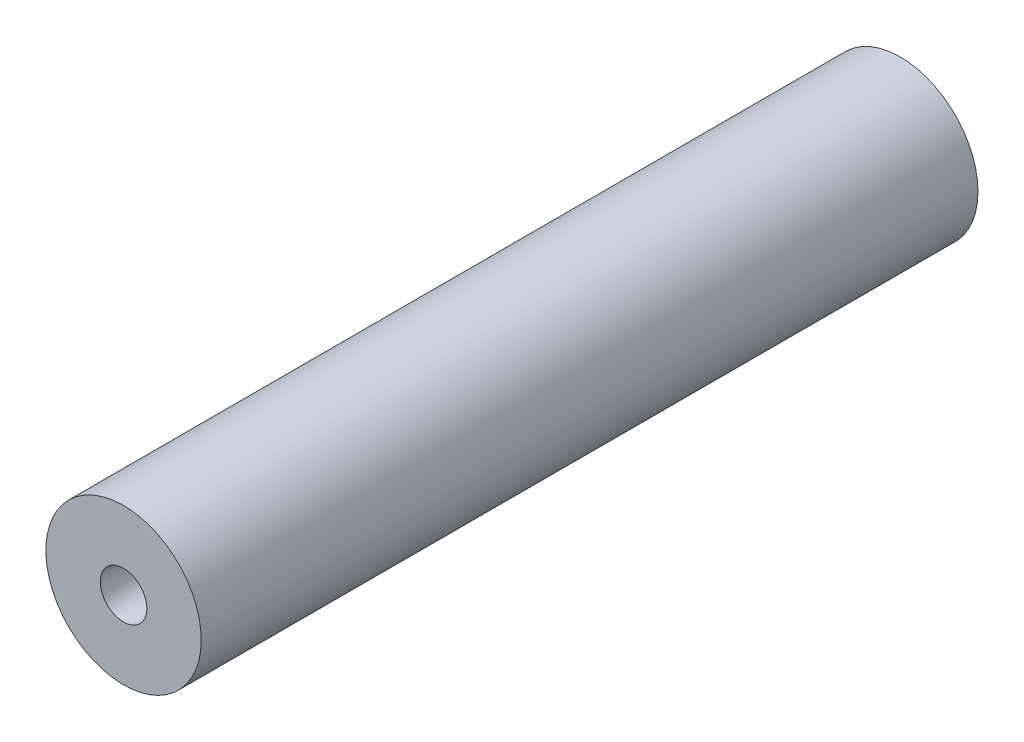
SolidWorks part; units mm, degrees
ref_plane "Plan de face" through (0, 0, 0) normal (0, 0, 1) x (1, 0, 0)
ref_plane "Plan de dessus" through (0, 0, 0) normal (0, 1, 0) x (1, 0, 0)
ref_plane "Plan de droite" through (0, 0, 0) normal (1, 0, 0) x (0, 0, -1)
sketch "Esquisse1" plane through (0, 0, 0) normal (0, 0, 1) x (1, 0, 0)
  circle A0 centre (0, 0) radius 10
  circle A1 centre (0, 0) radius 3
  dimension "D1" = 20
  dimension "D2" = 6
extrude "Boss.-Extru.1" add sketch "Esquisse1" along normal blind 100
